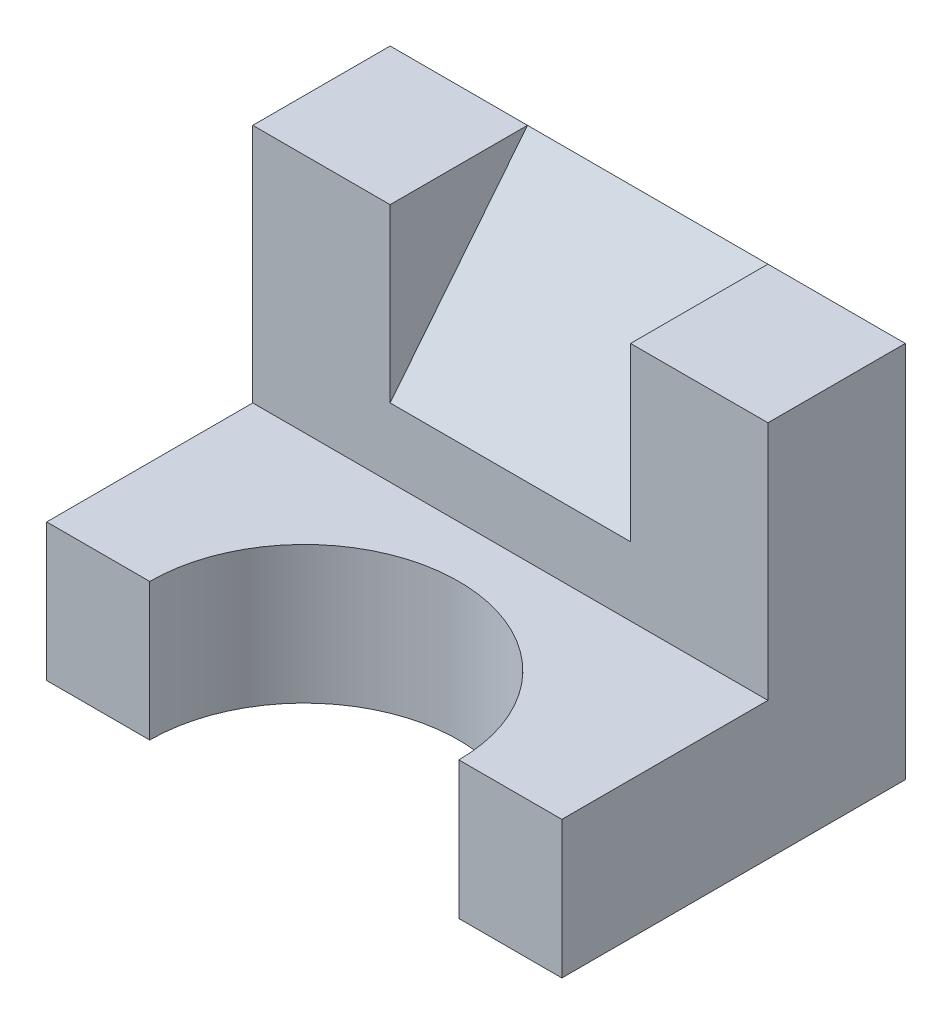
SolidWorks part; units mm, degrees
ref_plane "前视基准面" through (0, 0, 0) normal (0, 0, 1) x (1, 0, 0)
ref_plane "上视基准面" through (0, 0, 0) normal (0, 1, 0) x (1, 0, 0)
ref_plane "右视基准面" through (0, 0, 0) normal (1, 0, 0) x (0, 0, -1)
sketch "草图1" plane through (0, 0, 0) normal (0, 1, 0) x (1, 0, 0)
  line L1 (0, 0) -> (30, 0)
  line L2 (0, 0) -> (0, 20)
  line L3 (0, 20) -> (30, 20)
  line L4 (30, 0) -> (30, 20)
  dimension "D1" = 30
  dimension "D2" = 20
extrude "拉伸1" add sketch "草图1" along normal blind 8
sketch "草图2" plane through (0, 8, 0) normal (0, 1, 0) x (1, 0, 0)
  line L0 (30, 0) -> (30, 20) construction
  line L1 (0, 20) -> (30, 20)
  line L2 (0, 20) -> (0, 12)
  line L3 (0, 12) -> (30, 12)
  line L4 (30, 20) -> (30, 12)
  dimension "D1" = 8
extrude "拉伸2" add sketch "草图2" along normal blind 14
sketch "草图3" plane through (0, 8, 0) normal (0, 1, 0) x (1, 0, 0)
  line L0 (0, 0) -> (30, 0) construction
  circle A0 centre (15, 0) radius 9
  dimension "D1" = 18
extrude "切除-拉伸1" cut sketch "草图3" against normal through all
ref_plane "基准面1" through (8, 0, 0) normal (1, 0, 0) x (0, 0, -1)
sketch "草图4" plane through (8, 0, 0) normal (1, 0, 0) x (0, 0, -1)
  line L0 (12, 22) -> (20, 22)
  line L1 (12, 22) -> (12, 12)
  line L2 (12, 22) -> (12, 8) construction
  line L3 (12, 12) -> (20, 22)
  dimension "D1" = 10
extrude "切除-拉伸2" cut sketch "草图4" along normal blind 14
